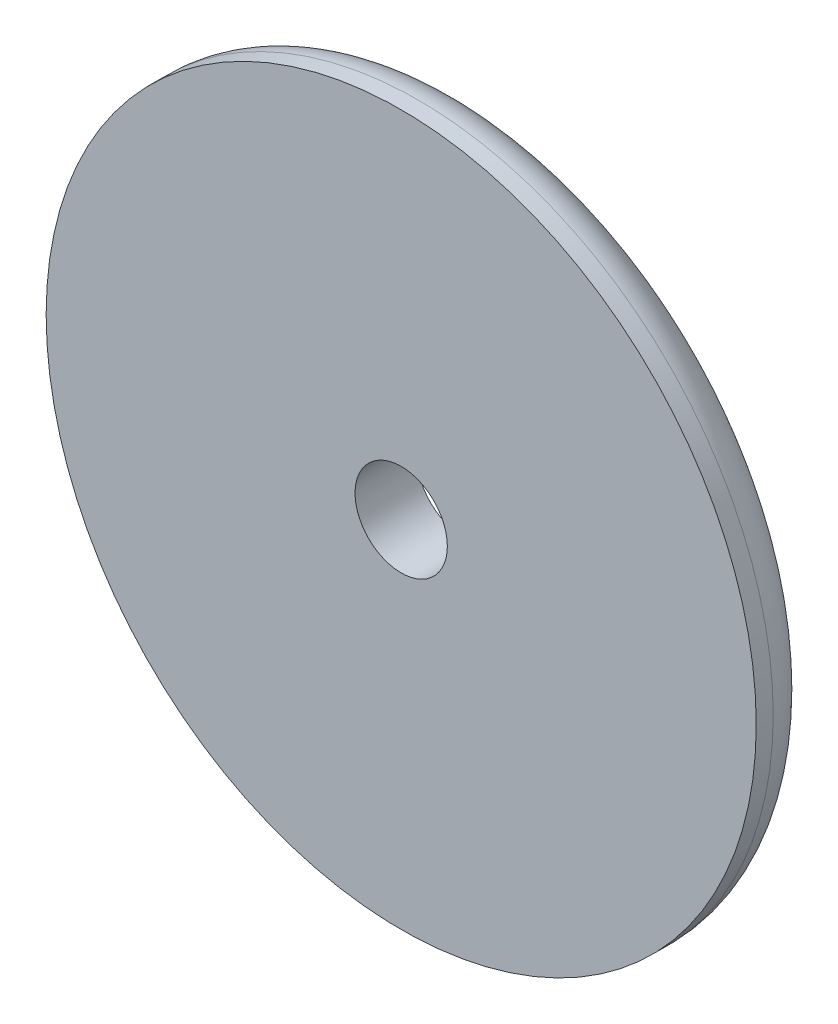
SolidWorks part; units mm, degrees
ref_plane "Front Plane" through (0, 0, 0) normal (0, 0, 1) x (1, 0, 0)
ref_plane "Top Plane" through (0, 0, 0) normal (0, 1, 0) x (1, 0, 0)
ref_plane "Right Plane" through (0, 0, 0) normal (1, 0, 0) x (0, 0, -1)
sketch "Sketch1" plane through (0, 0, 0) normal (0, 0, 1) x (1, 0, 0)
  circle A0 centre (0, 0) radius 12.5095
  dimension "D1" = 25.019
extrude "Boss-Extrude1" add sketch "Sketch1" along normal blind 2.1844
sketch "Sketch2" plane through (0, 0, 2.1844) normal (0, 0, 1) x (1, 0, 0)
  circle A0 centre (0, 0) radius 1.6256
  dimension "D1" = 3.2512
extrude "Cut-Extrude1" cut sketch "Sketch2" against normal through all
fillet "Fillet1" radius 1.5875 1 edges at (12.5095, 0, 0)
sketch "Sketch3" plane through (0, 0, 0) normal (0, 0, -1) x (-1, 0, 0)
  line L0 (5.8674, -7.493) -> (5.8674, -10.16) construction
  line L1 (6.6294, -7.493) -> (6.6294, -10.16)
  line L2 (5.1054, -7.493) -> (5.1054, -10.16)
  arc A0 (6.6294, -7.493) -> (5.1054, -7.493) centre (5.8674, -7.493) ccw
  arc A1 (5.1054, -10.16) -> (6.6294, -10.16) centre (5.8674, -10.16) ccw
  circle A2 centre (0, 0) radius 1.6256 construction
  point P2 (5.8674, -8.8265)
  dimension "D1" = 4.191
  dimension "D2" = 10.922
  dimension "D3" = 1.524
  dimension "D4" = 5.1054
extrude "Boss-Extrude2" add sketch "Sketch3" along normal blind 0.9652 and the other way up to surface
fillet "Fillet2" radius 0.762 4 edges at (-5.1054, -8.8265, -0.9652) (-5.8674, -6.731, -0.9652) (-6.6294, -8.8265, -0.9652) (-5.8674, -10.922, -0.9652)
mirror "Mirror1" about plane through (0, 0, 0) normal (1, 0, 0) of "Fillet2", "Boss-Extrude2"
sketch "Sketch4" plane through (0, 0, 0) normal (0, 0, -1) x (-1, 0, 0)
  line L0 (0, 0) -> (0, -14.1119) construction
  line L1 (0, -13.6684) -> (0, -9.525) construction
  line L2 (-1.5875, -13.6684) -> (-1.5875, -9.525)
  line L3 (1.5875, -13.6684) -> (1.5875, -9.525)
  arc A0 (-1.5875, -13.6684) -> (1.5875, -13.6684) centre (0, -13.6684) ccw
  arc A1 (1.5875, -9.525) -> (-1.5875, -9.525) centre (0, -9.525) ccw
  point P5 (0, -11.5967)
  dimension "D2" = 9.525
  dimension "D1" = 3.175
extrude "Cut-Extrude2" cut sketch "Sketch4" against normal blind 1.524
